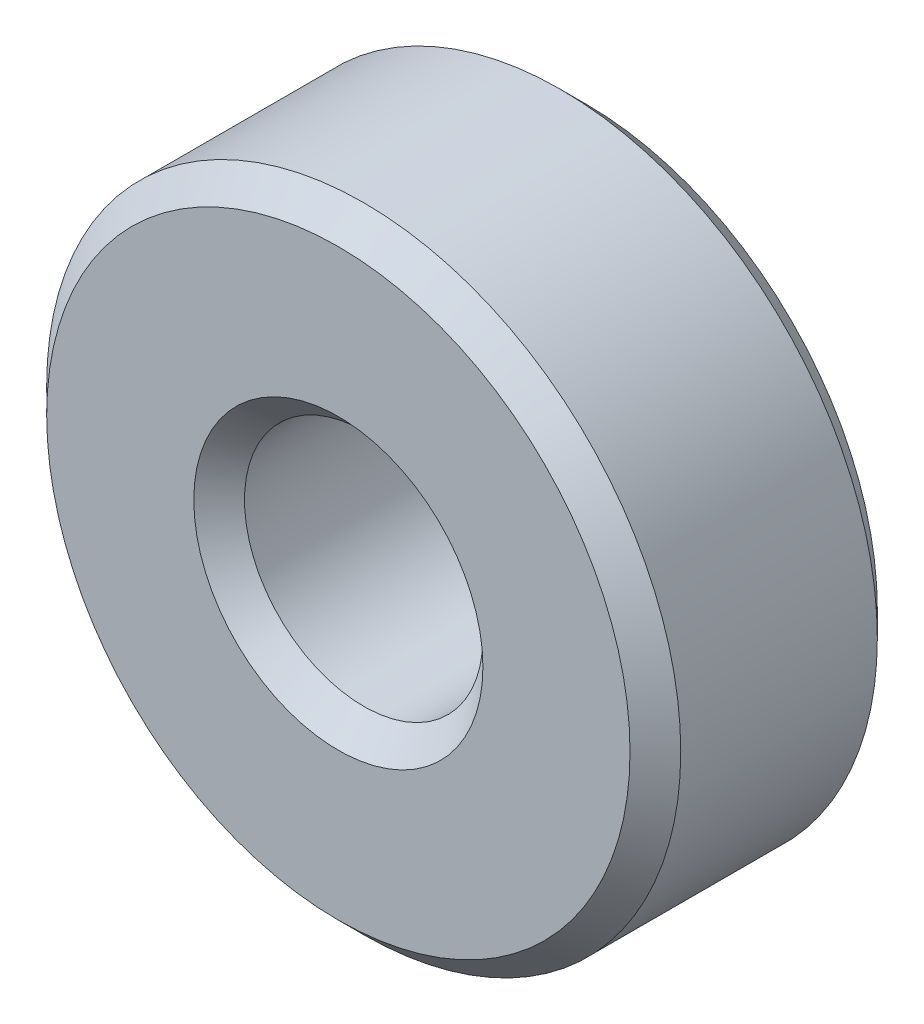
SolidWorks part; units mm, degrees
ref_plane "Front Plane" through (0, 0, 0) normal (0, 0, 1) x (1, 0, 0)
ref_plane "Top Plane" through (0, 0, 0) normal (0, 1, 0) x (1, 0, 0)
ref_plane "Right Plane" through (0, 0, 0) normal (1, 0, 0) x (0, 0, -1)
sketch "Sketch1" plane through (0, 0, 0) normal (0, 0, 1) x (1, 0, 0)
  circle A0 centre (0, 0) radius 6.35
  circle A1 centre (0, 0) radius 2.3876
  dimension "D1" = 12.7
  dimension "D2" = 4.7752
extrude "R3 ZZ Roller Bearing" add sketch "Sketch1" along normal blind 4.953
chamfer "Chamfer1" distance 0.508 angle 45 4 edges at (6.35, 0, 0) (6.35, 0, 4.953) (2.3876, 0, 0) (2.3876, 0, 4.953)
